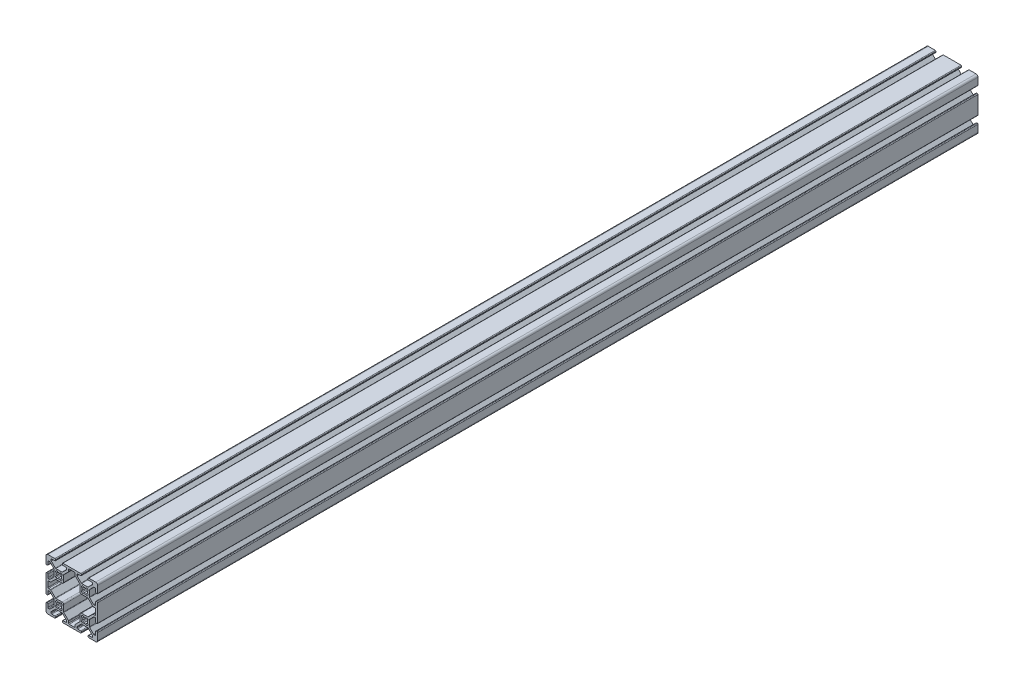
SolidWorks part; units mm, degrees
ref_plane "Front Plane" through (0, 0, 0) normal (0, 0, 1) x (1, 0, 0)
ref_plane "Top Plane" through (0, 0, 0) normal (0, 1, 0) x (1, 0, 0)
ref_plane "Right Plane" through (0, 0, 0) normal (1, 0, 0) x (0, 0, -1)
sketch "Sketch1" plane through (0, 0, 0) normal (0, 0, 1) x (1, 0, 0)
  line L0 (-16.6492, -131.4291) -> (-16.8288, -131.2495)
  line L1 (-16.8288, -126.9997) -> (-16.6492, -126.8201)
  line L2 (-12.3994, -126.8201) -> (-12.2198, -126.9997)
  line L3 (-12.2198, -131.2495) -> (-12.3994, -131.4291)
  line L4 (-36.6492, -131.4291) -> (-36.8288, -131.2495)
  line L5 (-36.8288, -126.9997) -> (-36.6492, -126.8201)
  line L6 (-32.3994, -126.8201) -> (-32.2198, -126.9997)
  line L7 (-32.2198, -131.2495) -> (-32.3994, -131.4291)
  line L8 (-16.6492, -151.4291) -> (-16.8288, -151.2495)
  line L9 (-16.8288, -146.9997) -> (-16.6492, -146.8201)
  line L10 (-12.3994, -146.8201) -> (-12.2198, -146.9997)
  line L11 (-12.2198, -151.2495) -> (-12.3994, -151.4291)
  line L12 (-27.0293, -157.1166) -> (-27.0293, -155.7694)
  line L13 (-27.1781, -155.4102) -> (-30.7205, -151.8677)
  line L14 (-30.8693, -151.5085) -> (-30.8693, -146.6126)
  line L15 (-32.0123, -145.4696) -> (-36.9082, -145.4696)
  line L16 (-37.2674, -145.3208) -> (-40.8098, -141.7784)
  line L17 (-41.169, -141.6296) -> (-42.5163, -141.6296)
  line L18 (-43.0243, -141.1216) -> (-43.0243, -137.1276)
  line L19 (-42.5163, -136.6196) -> (-41.169, -136.6196)
  line L20 (-40.8098, -136.4708) -> (-37.2674, -132.9284)
  line L21 (-36.9082, -132.7796) -> (-32.0123, -132.7796)
  line L22 (-30.8693, -131.6366) -> (-30.8693, -126.7407)
  line L23 (-30.7205, -126.3815) -> (-27.1781, -122.8391)
  line L24 (-27.0293, -122.4798) -> (-27.0293, -121.1326)
  line L25 (-26.5213, -120.6246) -> (-22.5273, -120.6246)
  line L26 (-22.0193, -121.1326) -> (-22.0193, -122.4798)
  line L27 (-21.8705, -122.8391) -> (-18.3281, -126.3815)
  line L28 (-18.1793, -126.7407) -> (-18.1793, -131.6366)
  line L29 (-17.0363, -132.7796) -> (-12.1404, -132.7796)
  line L30 (-11.7812, -132.9284) -> (-8.2387, -136.4708)
  line L31 (-7.8795, -136.6196) -> (-6.5323, -136.6196)
  line L32 (-6.0243, -137.1276) -> (-6.0243, -141.1216)
  line L33 (-6.5323, -141.6296) -> (-7.8795, -141.6296)
  line L34 (-8.2387, -141.7784) -> (-11.7812, -145.3208)
  line L35 (-12.1404, -145.4696) -> (-17.0363, -145.4696)
  line L36 (-18.1793, -146.6126) -> (-18.1793, -151.5085)
  line L37 (-18.3281, -151.8677) -> (-21.8705, -155.4102)
  line L38 (-22.0193, -155.7694) -> (-22.0193, -157.1166)
  line L39 (-22.5273, -157.6246) -> (-26.5213, -157.6246)
  line L40 (-36.6492, -151.4291) -> (-36.8288, -151.2495)
  line L41 (-36.8288, -146.9997) -> (-36.6492, -146.8201)
  line L42 (-32.3994, -146.8201) -> (-32.2198, -146.9997)
  line L43 (-32.2198, -151.2495) -> (-32.3994, -151.4291)
  line L44 (-36.9082, -152.7796) -> (-32.1404, -152.7796)
  line L45 (-31.7812, -152.9284) -> (-28.6781, -156.0315)
  line L46 (-28.5293, -156.3907) -> (-28.5293, -157.1166)
  line L47 (-29.0373, -157.6246) -> (-31.3863, -157.6246)
  line L48 (-31.8943, -158.1326) -> (-31.8943, -158.6166)
  line L49 (-31.3863, -159.1246) -> (-17.6623, -159.1246)
  line L50 (-17.1543, -158.6166) -> (-17.1543, -158.1326)
  line L51 (-17.6623, -157.6246) -> (-20.0113, -157.6246)
  line L52 (-20.5193, -157.1166) -> (-20.5193, -156.3907)
  line L53 (-20.3705, -156.0315) -> (-17.2674, -152.9284)
  line L54 (-16.9082, -152.7796) -> (-12.1404, -152.7796)
  line L55 (-11.7812, -152.9284) -> (-8.6781, -156.0315)
  line L56 (-8.5293, -156.3907) -> (-8.5293, -157.1166)
  line L57 (-9.0373, -157.6246) -> (-11.3863, -157.6246)
  line L58 (-11.8943, -158.1326) -> (-11.8943, -158.6166)
  line L59 (-11.3863, -159.1246) -> (-6.0243, -159.1246)
  line L60 (-4.5243, -157.6246) -> (-4.5243, -152.2626)
  line L61 (-5.0323, -151.7546) -> (-5.5163, -151.7546)
  line L62 (-6.0243, -152.2626) -> (-6.0243, -154.6116)
  line L63 (-6.5323, -155.1196) -> (-7.2582, -155.1196)
  line L64 (-7.6174, -154.9708) -> (-10.7205, -151.8677)
  line L65 (-10.8693, -151.5085) -> (-10.8693, -146.7407)
  line L66 (-10.7205, -146.3815) -> (-7.6174, -143.2784)
  line L67 (-7.2582, -143.1296) -> (-6.5323, -143.1296)
  line L68 (-6.0243, -143.6376) -> (-6.0243, -145.9866)
  line L69 (-5.5163, -146.4946) -> (-5.0323, -146.4946)
  line L70 (-4.5243, -145.9866) -> (-4.5243, -132.2626)
  line L71 (-5.0323, -131.7546) -> (-5.5163, -131.7546)
  line L72 (-6.0243, -132.2626) -> (-6.0243, -134.6116)
  line L73 (-6.5323, -135.1196) -> (-7.2582, -135.1196)
  line L74 (-7.6174, -134.9708) -> (-10.7205, -131.8677)
  line L75 (-10.8693, -131.5085) -> (-10.8693, -126.7407)
  line L76 (-10.7205, -126.3815) -> (-7.6174, -123.2784)
  line L77 (-7.2582, -123.1296) -> (-6.5323, -123.1296)
  line L78 (-6.0243, -123.6376) -> (-6.0243, -125.9866)
  line L79 (-5.5163, -126.4946) -> (-5.0323, -126.4946)
  line L80 (-4.5243, -125.9866) -> (-4.5243, -120.6246)
  line L81 (-6.0243, -119.1246) -> (-11.3863, -119.1246)
  line L82 (-11.8943, -119.6326) -> (-11.8943, -120.1166)
  line L83 (-11.3863, -120.6246) -> (-9.0373, -120.6246)
  line L84 (-8.5293, -121.1326) -> (-8.5293, -121.8585)
  line L85 (-8.6781, -122.2177) -> (-11.7812, -125.3208)
  line L86 (-12.1404, -125.4696) -> (-16.9082, -125.4696)
  line L87 (-17.2674, -125.3208) -> (-20.3705, -122.2177)
  line L88 (-20.5193, -121.8585) -> (-20.5193, -121.1326)
  line L89 (-20.0113, -120.6246) -> (-17.6623, -120.6246)
  line L90 (-17.1543, -120.1166) -> (-17.1543, -119.6326)
  line L91 (-17.6623, -119.1246) -> (-31.3863, -119.1246)
  line L92 (-31.8943, -119.6326) -> (-31.8943, -120.1166)
  line L93 (-31.3863, -120.6246) -> (-29.0373, -120.6246)
  line L94 (-28.5293, -121.1326) -> (-28.5293, -121.8585)
  line L95 (-28.6781, -122.2177) -> (-31.7812, -125.3208)
  line L96 (-32.1404, -125.4696) -> (-36.9082, -125.4696)
  line L97 (-37.2674, -125.3208) -> (-40.3705, -122.2177)
  line L98 (-40.5193, -121.8585) -> (-40.5193, -121.1326)
  line L99 (-40.0113, -120.6246) -> (-37.6623, -120.6246)
  line L100 (-37.1543, -120.1166) -> (-37.1543, -119.6326)
  line L101 (-37.6623, -119.1246) -> (-43.0243, -119.1246)
  line L102 (-44.5243, -120.6246) -> (-44.5243, -125.9866)
  line L103 (-44.0163, -126.4946) -> (-43.5323, -126.4946)
  line L104 (-43.0243, -125.9866) -> (-43.0243, -123.6376)
  line L105 (-42.5163, -123.1296) -> (-41.7904, -123.1296)
  line L106 (-41.4312, -123.2784) -> (-38.3281, -126.3815)
  line L107 (-38.1793, -126.7407) -> (-38.1793, -131.5085)
  line L108 (-38.3281, -131.8677) -> (-41.4312, -134.9708)
  line L109 (-41.7904, -135.1196) -> (-42.5163, -135.1196)
  line L110 (-43.0243, -134.6116) -> (-43.0243, -132.2626)
  line L111 (-43.5323, -131.7546) -> (-44.0163, -131.7546)
  line L112 (-44.5243, -132.2626) -> (-44.5243, -145.9866)
  line L113 (-44.0163, -146.4946) -> (-43.5323, -146.4946)
  line L114 (-43.0243, -145.9866) -> (-43.0243, -143.6376)
  line L115 (-42.5163, -143.1296) -> (-41.7904, -143.1296)
  line L116 (-41.4312, -143.2784) -> (-38.3281, -146.3815)
  line L117 (-38.1793, -146.7407) -> (-38.1793, -151.5085)
  line L118 (-38.3281, -151.8677) -> (-41.4312, -154.9708)
  line L119 (-41.7904, -155.1196) -> (-42.5163, -155.1196)
  line L120 (-43.0243, -154.6116) -> (-43.0243, -152.2626)
  line L121 (-43.5323, -151.7546) -> (-44.0163, -151.7546)
  line L122 (-44.5243, -152.2626) -> (-44.5243, -157.6246)
  line L123 (-43.0243, -159.1246) -> (-37.6623, -159.1246)
  line L124 (-37.1543, -158.6166) -> (-37.1543, -158.1326)
  line L125 (-37.6623, -157.6246) -> (-40.0113, -157.6246)
  line L126 (-40.5193, -157.1166) -> (-40.5193, -156.3907)
  line L127 (-40.3705, -156.0315) -> (-37.2674, -152.9284)
  arc A0 (-16.4594, -129.9286) -> (-16.8288, -131.2495) centre (-16.2723, -130.693) ccw
  arc A1 (-16.4594, -128.3206) -> (-16.4594, -129.9286) centre (-14.5243, -129.1246) ccw
  arc A2 (-16.8288, -126.9997) -> (-16.4594, -128.3206) centre (-16.2723, -127.5562) ccw
  arc A3 (-15.3283, -127.1895) -> (-16.6492, -126.8201) centre (-16.0927, -127.3766) ccw
  arc A4 (-13.7203, -127.1895) -> (-15.3283, -127.1895) centre (-14.5243, -129.1246) ccw
  arc A5 (-12.3994, -126.8201) -> (-13.7203, -127.1895) centre (-12.9559, -127.3766) ccw
  arc A6 (-12.5892, -128.3206) -> (-12.2198, -126.9997) centre (-12.7763, -127.5562) ccw
  arc A7 (-12.5892, -129.9286) -> (-12.5892, -128.3206) centre (-14.5243, -129.1246) ccw
  arc A8 (-12.2198, -131.2495) -> (-12.5892, -129.9286) centre (-12.7763, -130.693) ccw
  arc A9 (-13.7203, -131.0597) -> (-12.3994, -131.4291) centre (-12.9559, -130.8726) ccw
  arc A10 (-15.3283, -131.0597) -> (-13.7203, -131.0597) centre (-14.5243, -129.1246) ccw
  arc A11 (-16.6492, -131.4291) -> (-15.3283, -131.0597) centre (-16.0927, -130.8726) ccw
  arc A12 (-36.4594, -129.9286) -> (-36.8288, -131.2495) centre (-36.2723, -130.693) ccw
  arc A13 (-36.4594, -128.3206) -> (-36.4594, -129.9286) centre (-34.5243, -129.1246) ccw
  arc A14 (-36.8288, -126.9997) -> (-36.4594, -128.3206) centre (-36.2723, -127.5562) ccw
  arc A15 (-35.3283, -127.1895) -> (-36.6492, -126.8201) centre (-36.0927, -127.3766) ccw
  arc A16 (-33.7203, -127.1895) -> (-35.3283, -127.1895) centre (-34.5243, -129.1246) ccw
  arc A17 (-32.3994, -126.8201) -> (-33.7203, -127.1895) centre (-32.9559, -127.3766) ccw
  arc A18 (-32.5892, -128.3206) -> (-32.2198, -126.9997) centre (-32.7763, -127.5562) ccw
  arc A19 (-32.5892, -129.9286) -> (-32.5892, -128.3206) centre (-34.5243, -129.1246) ccw
  arc A20 (-32.2198, -131.2495) -> (-32.5892, -129.9286) centre (-32.7763, -130.693) ccw
  arc A21 (-33.7203, -131.0597) -> (-32.3994, -131.4291) centre (-32.9559, -130.8726) ccw
  arc A22 (-35.3283, -131.0597) -> (-33.7203, -131.0597) centre (-34.5243, -129.1246) ccw
  arc A23 (-36.6492, -131.4291) -> (-35.3283, -131.0597) centre (-36.0927, -130.8726) ccw
  arc A24 (-16.4594, -149.9286) -> (-16.8288, -151.2495) centre (-16.2723, -150.693) ccw
  arc A25 (-16.4594, -148.3206) -> (-16.4594, -149.9286) centre (-14.5243, -149.1246) ccw
  arc A26 (-16.8288, -146.9997) -> (-16.4594, -148.3206) centre (-16.2723, -147.5562) ccw
  arc A27 (-15.3283, -147.1895) -> (-16.6492, -146.8201) centre (-16.0927, -147.3766) ccw
  arc A28 (-13.7203, -147.1895) -> (-15.3283, -147.1895) centre (-14.5243, -149.1246) ccw
  arc A29 (-12.3994, -146.8201) -> (-13.7203, -147.1895) centre (-12.9559, -147.3766) ccw
  arc A30 (-12.5892, -148.3206) -> (-12.2198, -146.9997) centre (-12.7763, -147.5562) ccw
  arc A31 (-12.5892, -149.9286) -> (-12.5892, -148.3206) centre (-14.5243, -149.1246) ccw
  arc A32 (-12.2198, -151.2495) -> (-12.5892, -149.9286) centre (-12.7763, -150.693) ccw
  arc A33 (-13.7203, -151.0597) -> (-12.3994, -151.4291) centre (-12.9559, -150.8726) ccw
  arc A34 (-15.3283, -151.0597) -> (-13.7203, -151.0597) centre (-14.5243, -149.1246) ccw
  arc A35 (-16.6492, -151.4291) -> (-15.3283, -151.0597) centre (-16.0927, -150.8726) ccw
  arc A36 (-27.0293, -157.1166) -> (-26.5213, -157.6246) centre (-26.5213, -157.1166) ccw
  arc A37 (-27.0293, -155.7694) -> (-27.1781, -155.4102) centre (-27.5373, -155.7694) ccw
  arc A38 (-30.8693, -151.5085) -> (-30.7205, -151.8677) centre (-30.3613, -151.5085) ccw
  arc A39 (-30.8693, -146.6126) -> (-32.0123, -145.4696) centre (-32.0123, -146.6126) ccw
  arc A40 (-37.2674, -145.3208) -> (-36.9082, -145.4696) centre (-36.9082, -144.9616) ccw
  arc A41 (-40.8098, -141.7784) -> (-41.169, -141.6296) centre (-41.169, -142.1376) ccw
  arc A42 (-43.0243, -141.1216) -> (-42.5163, -141.6296) centre (-42.5163, -141.1216) ccw
  arc A43 (-42.5163, -136.6196) -> (-43.0243, -137.1276) centre (-42.5163, -137.1276) ccw
  arc A44 (-41.169, -136.6196) -> (-40.8098, -136.4708) centre (-41.169, -136.1116) ccw
  arc A45 (-36.9082, -132.7796) -> (-37.2674, -132.9284) centre (-36.9082, -133.2876) ccw
  arc A46 (-32.0123, -132.7796) -> (-30.8693, -131.6366) centre (-32.0123, -131.6366) ccw
  arc A47 (-30.7205, -126.3815) -> (-30.8693, -126.7407) centre (-30.3613, -126.7407) ccw
  arc A48 (-27.1781, -122.8391) -> (-27.0293, -122.4798) centre (-27.5373, -122.4798) ccw
  arc A49 (-26.5213, -120.6246) -> (-27.0293, -121.1326) centre (-26.5213, -121.1326) ccw
  arc A50 (-22.0193, -121.1326) -> (-22.5273, -120.6246) centre (-22.5273, -121.1326) ccw
  arc A51 (-22.0193, -122.4798) -> (-21.8705, -122.8391) centre (-21.5113, -122.4798) ccw
  arc A52 (-18.1793, -126.7407) -> (-18.3281, -126.3815) centre (-18.6873, -126.7407) ccw
  arc A53 (-18.1793, -131.6366) -> (-17.0363, -132.7796) centre (-17.0363, -131.6366) ccw
  arc A54 (-11.7812, -132.9284) -> (-12.1404, -132.7796) centre (-12.1404, -133.2876) ccw
  arc A55 (-8.2387, -136.4708) -> (-7.8795, -136.6196) centre (-7.8795, -136.1116) ccw
  arc A56 (-6.0243, -137.1276) -> (-6.5323, -136.6196) centre (-6.5323, -137.1276) ccw
  arc A57 (-6.5323, -141.6296) -> (-6.0243, -141.1216) centre (-6.5323, -141.1216) ccw
  arc A58 (-7.8795, -141.6296) -> (-8.2387, -141.7784) centre (-7.8795, -142.1376) ccw
  arc A59 (-12.1404, -145.4696) -> (-11.7812, -145.3208) centre (-12.1404, -144.9616) ccw
  arc A60 (-17.0363, -145.4696) -> (-18.1793, -146.6126) centre (-17.0363, -146.6126) ccw
  arc A61 (-18.3281, -151.8677) -> (-18.1793, -151.5085) centre (-18.6873, -151.5085) ccw
  arc A62 (-21.8705, -155.4102) -> (-22.0193, -155.7694) centre (-21.5113, -155.7694) ccw
  arc A63 (-22.5273, -157.6246) -> (-22.0193, -157.1166) centre (-22.5273, -157.1166) ccw
  arc A64 (-36.4594, -149.9286) -> (-36.8288, -151.2495) centre (-36.2723, -150.693) ccw
  arc A65 (-36.4594, -148.3206) -> (-36.4594, -149.9286) centre (-34.5243, -149.1246) ccw
  arc A66 (-36.8288, -146.9997) -> (-36.4594, -148.3206) centre (-36.2723, -147.5562) ccw
  arc A67 (-35.3283, -147.1895) -> (-36.6492, -146.8201) centre (-36.0927, -147.3766) ccw
  arc A68 (-33.7203, -147.1895) -> (-35.3283, -147.1895) centre (-34.5243, -149.1246) ccw
  arc A69 (-32.3994, -146.8201) -> (-33.7203, -147.1895) centre (-32.9559, -147.3766) ccw
  arc A70 (-32.5892, -148.3206) -> (-32.2198, -146.9997) centre (-32.7763, -147.5562) ccw
  arc A71 (-32.5892, -149.9286) -> (-32.5892, -148.3206) centre (-34.5243, -149.1246) ccw
  arc A72 (-32.2198, -151.2495) -> (-32.5892, -149.9286) centre (-32.7763, -150.693) ccw
  arc A73 (-33.7203, -151.0597) -> (-32.3994, -151.4291) centre (-32.9559, -150.8726) ccw
  arc A74 (-35.3283, -151.0597) -> (-33.7203, -151.0597) centre (-34.5243, -149.1246) ccw
  arc A75 (-36.6492, -151.4291) -> (-35.3283, -151.0597) centre (-36.0927, -150.8726) ccw
  arc A76 (-36.9082, -152.7796) -> (-37.2674, -152.9284) centre (-36.9082, -153.2876) ccw
  arc A77 (-31.7812, -152.9284) -> (-32.1404, -152.7796) centre (-32.1404, -153.2876) ccw
  arc A78 (-28.5293, -156.3907) -> (-28.6781, -156.0315) centre (-29.0373, -156.3907) ccw
  arc A79 (-29.0373, -157.6246) -> (-28.5293, -157.1166) centre (-29.0373, -157.1166) ccw
  arc A80 (-31.3863, -157.6246) -> (-31.8943, -158.1326) centre (-31.3863, -158.1326) ccw
  arc A81 (-31.8943, -158.6166) -> (-31.3863, -159.1246) centre (-31.3863, -158.6166) ccw
  arc A82 (-17.6623, -159.1246) -> (-17.1543, -158.6166) centre (-17.6623, -158.6166) ccw
  arc A83 (-17.1543, -158.1326) -> (-17.6623, -157.6246) centre (-17.6623, -158.1326) ccw
  arc A84 (-20.5193, -157.1166) -> (-20.0113, -157.6246) centre (-20.0113, -157.1166) ccw
  arc A85 (-20.3705, -156.0315) -> (-20.5193, -156.3907) centre (-20.0113, -156.3907) ccw
  arc A86 (-16.9082, -152.7796) -> (-17.2674, -152.9284) centre (-16.9082, -153.2876) ccw
  arc A87 (-11.7812, -152.9284) -> (-12.1404, -152.7796) centre (-12.1404, -153.2876) ccw
  arc A88 (-8.5293, -156.3907) -> (-8.6781, -156.0315) centre (-9.0373, -156.3907) ccw
  arc A89 (-9.0373, -157.6246) -> (-8.5293, -157.1166) centre (-9.0373, -157.1166) ccw
  arc A90 (-11.3863, -157.6246) -> (-11.8943, -158.1326) centre (-11.3863, -158.1326) ccw
  arc A91 (-11.8943, -158.6166) -> (-11.3863, -159.1246) centre (-11.3863, -158.6166) ccw
  arc A92 (-6.0243, -159.1246) -> (-4.5243, -157.6246) centre (-6.0243, -157.6246) ccw
  arc A93 (-4.5243, -152.2626) -> (-5.0323, -151.7546) centre (-5.0323, -152.2626) ccw
  arc A94 (-5.5163, -151.7546) -> (-6.0243, -152.2626) centre (-5.5163, -152.2626) ccw
  arc A95 (-6.5323, -155.1196) -> (-6.0243, -154.6116) centre (-6.5323, -154.6116) ccw
  arc A96 (-7.6174, -154.9708) -> (-7.2582, -155.1196) centre (-7.2582, -154.6116) ccw
  arc A97 (-10.8693, -151.5085) -> (-10.7205, -151.8677) centre (-10.3613, -151.5085) ccw
  arc A98 (-10.7205, -146.3815) -> (-10.8693, -146.7407) centre (-10.3613, -146.7407) ccw
  arc A99 (-7.2582, -143.1296) -> (-7.6174, -143.2784) centre (-7.2582, -143.6376) ccw
  arc A100 (-6.0243, -143.6376) -> (-6.5323, -143.1296) centre (-6.5323, -143.6376) ccw
  arc A101 (-6.0243, -145.9866) -> (-5.5163, -146.4946) centre (-5.5163, -145.9866) ccw
  arc A102 (-5.0323, -146.4946) -> (-4.5243, -145.9866) centre (-5.0323, -145.9866) ccw
  arc A103 (-4.5243, -132.2626) -> (-5.0323, -131.7546) centre (-5.0323, -132.2626) ccw
  arc A104 (-5.5163, -131.7546) -> (-6.0243, -132.2626) centre (-5.5163, -132.2626) ccw
  arc A105 (-6.5323, -135.1196) -> (-6.0243, -134.6116) centre (-6.5323, -134.6116) ccw
  arc A106 (-7.6174, -134.9708) -> (-7.2582, -135.1196) centre (-7.2582, -134.6116) ccw
  arc A107 (-10.8693, -131.5085) -> (-10.7205, -131.8677) centre (-10.3613, -131.5085) ccw
  arc A108 (-10.7205, -126.3815) -> (-10.8693, -126.7407) centre (-10.3613, -126.7407) ccw
  arc A109 (-7.2582, -123.1296) -> (-7.6174, -123.2784) centre (-7.2582, -123.6376) ccw
  arc A110 (-6.0243, -123.6376) -> (-6.5323, -123.1296) centre (-6.5323, -123.6376) ccw
  arc A111 (-6.0243, -125.9866) -> (-5.5163, -126.4946) centre (-5.5163, -125.9866) ccw
  arc A112 (-5.0323, -126.4946) -> (-4.5243, -125.9866) centre (-5.0323, -125.9866) ccw
  arc A113 (-4.5243, -120.6246) -> (-6.0243, -119.1246) centre (-6.0243, -120.6246) ccw
  arc A114 (-11.3863, -119.1246) -> (-11.8943, -119.6326) centre (-11.3863, -119.6326) ccw
  arc A115 (-11.8943, -120.1166) -> (-11.3863, -120.6246) centre (-11.3863, -120.1166) ccw
  arc A116 (-8.5293, -121.1326) -> (-9.0373, -120.6246) centre (-9.0373, -121.1326) ccw
  arc A117 (-8.6781, -122.2177) -> (-8.5293, -121.8585) centre (-9.0373, -121.8585) ccw
  arc A118 (-12.1404, -125.4696) -> (-11.7812, -125.3208) centre (-12.1404, -124.9616) ccw
  arc A119 (-17.2674, -125.3208) -> (-16.9082, -125.4696) centre (-16.9082, -124.9616) ccw
  arc A120 (-20.5193, -121.8585) -> (-20.3705, -122.2177) centre (-20.0113, -121.8585) ccw
  arc A121 (-20.0113, -120.6246) -> (-20.5193, -121.1326) centre (-20.0113, -121.1326) ccw
  arc A122 (-17.6623, -120.6246) -> (-17.1543, -120.1166) centre (-17.6623, -120.1166) ccw
  arc A123 (-17.1543, -119.6326) -> (-17.6623, -119.1246) centre (-17.6623, -119.6326) ccw
  arc A124 (-31.3863, -119.1246) -> (-31.8943, -119.6326) centre (-31.3863, -119.6326) ccw
  arc A125 (-31.8943, -120.1166) -> (-31.3863, -120.6246) centre (-31.3863, -120.1166) ccw
  arc A126 (-28.5293, -121.1326) -> (-29.0373, -120.6246) centre (-29.0373, -121.1326) ccw
  arc A127 (-28.6781, -122.2177) -> (-28.5293, -121.8585) centre (-29.0373, -121.8585) ccw
  arc A128 (-32.1404, -125.4696) -> (-31.7812, -125.3208) centre (-32.1404, -124.9616) ccw
  arc A129 (-37.2674, -125.3208) -> (-36.9082, -125.4696) centre (-36.9082, -124.9616) ccw
  arc A130 (-40.5193, -121.8585) -> (-40.3705, -122.2177) centre (-40.0113, -121.8585) ccw
  arc A131 (-40.0113, -120.6246) -> (-40.5193, -121.1326) centre (-40.0113, -121.1326) ccw
  arc A132 (-37.6623, -120.6246) -> (-37.1543, -120.1166) centre (-37.6623, -120.1166) ccw
  arc A133 (-37.1543, -119.6326) -> (-37.6623, -119.1246) centre (-37.6623, -119.6326) ccw
  arc A134 (-43.0243, -119.1246) -> (-44.5243, -120.6246) centre (-43.0243, -120.6246) ccw
  arc A135 (-44.5243, -125.9866) -> (-44.0163, -126.4946) centre (-44.0163, -125.9866) ccw
  arc A136 (-43.5323, -126.4946) -> (-43.0243, -125.9866) centre (-43.5323, -125.9866) ccw
  arc A137 (-42.5163, -123.1296) -> (-43.0243, -123.6376) centre (-42.5163, -123.6376) ccw
  arc A138 (-41.4312, -123.2784) -> (-41.7904, -123.1296) centre (-41.7904, -123.6376) ccw
  arc A139 (-38.1793, -126.7407) -> (-38.3281, -126.3815) centre (-38.6873, -126.7407) ccw
  arc A140 (-38.3281, -131.8677) -> (-38.1793, -131.5085) centre (-38.6873, -131.5085) ccw
  arc A141 (-41.7904, -135.1196) -> (-41.4312, -134.9708) centre (-41.7904, -134.6116) ccw
  arc A142 (-43.0243, -134.6116) -> (-42.5163, -135.1196) centre (-42.5163, -134.6116) ccw
  arc A143 (-43.0243, -132.2626) -> (-43.5323, -131.7546) centre (-43.5323, -132.2626) ccw
  arc A144 (-44.0163, -131.7546) -> (-44.5243, -132.2626) centre (-44.0163, -132.2626) ccw
  arc A145 (-44.5243, -145.9866) -> (-44.0163, -146.4946) centre (-44.0163, -145.9866) ccw
  arc A146 (-43.5323, -146.4946) -> (-43.0243, -145.9866) centre (-43.5323, -145.9866) ccw
  arc A147 (-42.5163, -143.1296) -> (-43.0243, -143.6376) centre (-42.5163, -143.6376) ccw
  arc A148 (-41.4312, -143.2784) -> (-41.7904, -143.1296) centre (-41.7904, -143.6376) ccw
  arc A149 (-38.1793, -146.7407) -> (-38.3281, -146.3815) centre (-38.6873, -146.7407) ccw
  arc A150 (-38.3281, -151.8677) -> (-38.1793, -151.5085) centre (-38.6873, -151.5085) ccw
  arc A151 (-41.7904, -155.1196) -> (-41.4312, -154.9708) centre (-41.7904, -154.6116) ccw
  arc A152 (-43.0243, -154.6116) -> (-42.5163, -155.1196) centre (-42.5163, -154.6116) ccw
  arc A153 (-43.0243, -152.2626) -> (-43.5323, -151.7546) centre (-43.5323, -152.2626) ccw
  arc A154 (-44.0163, -151.7546) -> (-44.5243, -152.2626) centre (-44.0163, -152.2626) ccw
  arc A155 (-44.5243, -157.6246) -> (-43.0243, -159.1246) centre (-43.0243, -157.6246) ccw
  arc A156 (-37.6623, -159.1246) -> (-37.1543, -158.6166) centre (-37.6623, -158.6166) ccw
  arc A157 (-37.1543, -158.1326) -> (-37.6623, -157.6246) centre (-37.6623, -158.1326) ccw
  arc A158 (-40.5193, -157.1166) -> (-40.0113, -157.6246) centre (-40.0113, -157.1166) ccw
  arc A159 (-40.3705, -156.0315) -> (-40.5193, -156.3907) centre (-40.0113, -156.3907) ccw
extrude "Extrude1" add sketch "Sketch1" along normal blind 682.117
